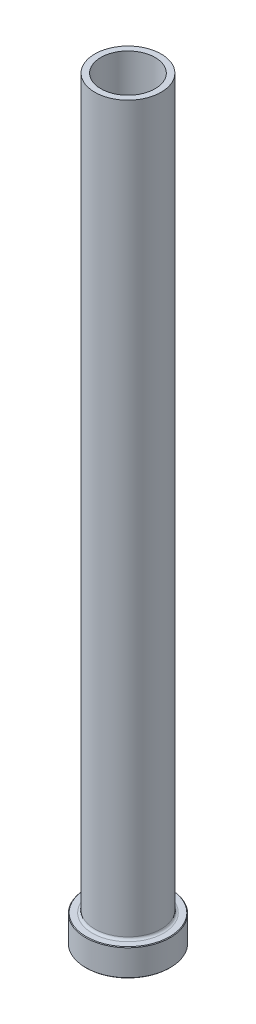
SolidWorks part; units mm, degrees
ref_plane "Front Plane" through (0, 0, 0) normal (0, 0, 1) x (1, 0, 0)
ref_plane "Top Plane" through (0, 0, 0) normal (0, 1, 0) x (1, 0, 0)
ref_plane "Right Plane" through (0, 0, 0) normal (1, 0, 0) x (0, 0, -1)
sketch "Sketch1" plane through (0, 0, 0) normal (0, 0, 1) x (1, 0, 0)
  line L0 (-9, 250) -> (-11, 250)
  line L1 (-11, 250) -> (-11, 9)
  line L2 (-11, 9) -> (-14, 9)
  line L3 (-14, 9) -> (-14, 0)
  line L4 (15.4, 0) -> (-15.4, 0) construction
  line L5 (-14, 0) -> (-9.25, 0)
  line L6 (-9, 195) -> (-9, 250)
  line L7 (0, 92.1877) -> (0, -15.5353) construction
  line L8 (0, -15.4) -> (0, 15.4) construction
  line L9 (-9, 195) -> (-9.25, 183)
  line L10 (-9.25, 183) -> (-9.25, 0)
  dimension "D1" = 0.25
  dimension "ID" = 18
  dimension "OD" = 22
  dimension "L" = 250
  dimension "H" = 28
  dimension "T" = 9
  dimension "N" = 55
  dimension "D2" = 12
revolve "Revolve1" add sketch "Sketch1" angle 360 about L7
fillet "Fillet1" radius 0.8 1 edges at (0, 9, 11)
chamfer "Chamfer1" distance 0.2 angle 45 2 edges at (0, 9, 14) (0, 0, 14)
chamfer "Chamfer3" distance 0.5 angle 45 1 edges at (0, 0, 9.25)
